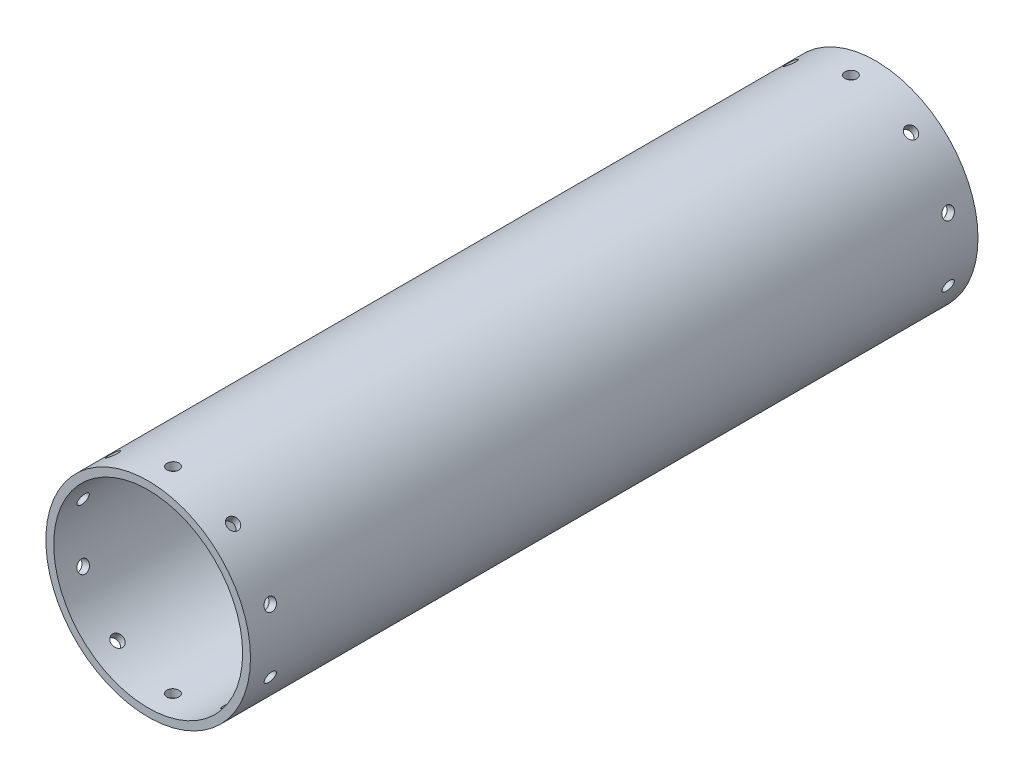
SolidWorks part; units mm, degrees
ref_plane "Front Plane" through (0, 0, 0) normal (0, 0, 1) x (1, 0, 0)
ref_plane "Top Plane" through (0, 0, 0) normal (0, 1, 0) x (1, 0, 0)
ref_plane "Right Plane" through (0, 0, 0) normal (1, 0, 0) x (0, 0, -1)
sketch "Sketch1" plane through (0, 0, 0) normal (0, 0, 1) x (1, 0, 0)
  circle A0 centre (0, 0) radius 41.275
  circle A1 centre (0, 0) radius 38.1
  dimension "D1" = 76.2
  dimension "D2" = 82.55
extrude "Boss-Extrude2" add sketch "Sketch1" along normal blind 293.4445 contours A0 | A1
ref_plane "Plane1" through (0, 41.275, 0) normal (0, 1, 0) x (1, 0, 0)
sketch "Sketch4" plane through (0, 41.275, 0) normal (0, 1, 0) x (1, 0, 0)
  line L0 (38.1, 0) -> (-38.1, 0) construction
  circle A0 centre (0, -10) radius 2.413
extrude "Cut-Extrude1" cut sketch "Sketch4" against normal up to next
pattern_circular "CirPattern1" count 10 over 360 about axis through (0, 0, 293.4445) along (0, 0, -1) of "Cut-Extrude1"
sketch "Sketch5" plane through (0, 41.275, 0) normal (0, 1, 0) x (1, 0, 0)
  line L0 (-41.275, -293.4445) -> (41.275, -293.4445) construction
  line L1 (-41.275, -293.4445) -> (41.275, -293.4445) construction
  circle A0 centre (0, -283.4445) radius 2.413
  point P4 (0, -293.4445)
extrude "Cut-Extrude2" cut sketch "Sketch5" against normal up to next
pattern_circular "CirPattern2" count 10 over 360 about axis through (0, 0, 293.4445) along (0, 0, -1) of "Cut-Extrude2"
equation "\"FGL\"= 5in'Fuel Grain Length"
equation "\"B\" = 0.89244in'Bulkhead"
equation "\"ID\"= 2.225in'Inner Diameter"
equation "\"D1@Boss-Extrude2\" = \"FGL\" + 1.5 * \"ID\" + 4 * \"TS\" + \"EL\" + \"B\""
equation "\"TS\"= 0.393701in'Tear-Out Stress Distance"
equation "\"D2@Sketch4\"=\"TS\""
equation "\"D2@Sketch5\"=\"TS\""
equation "\"EL\"= 0.74819in'Entrance Length"
